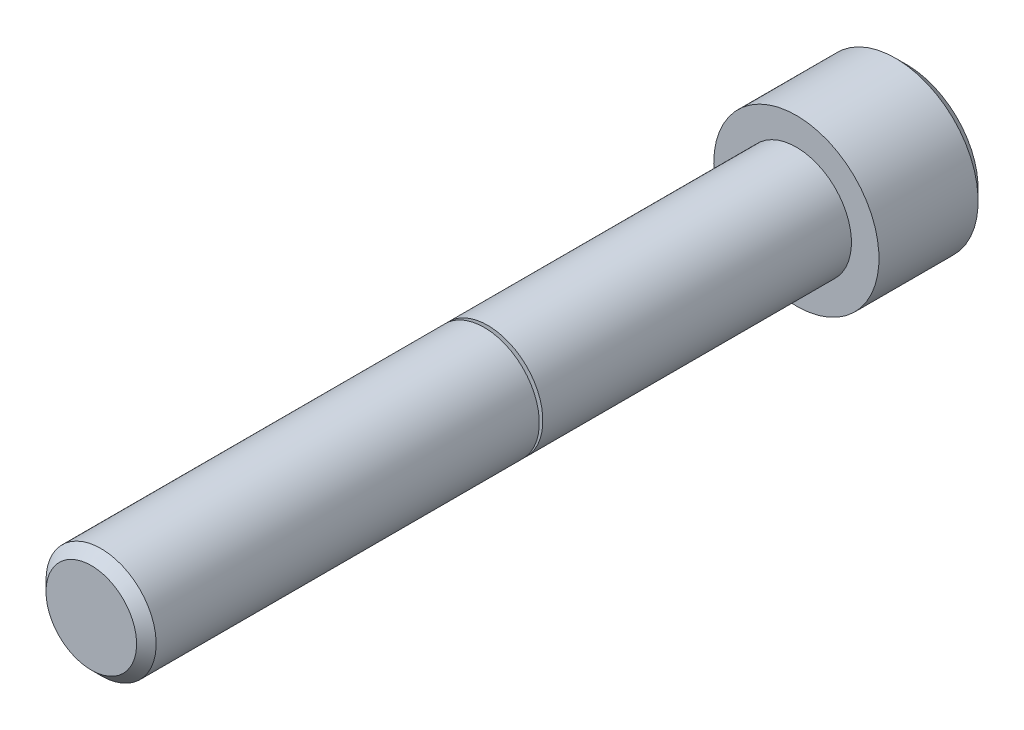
SolidWorks part; units mm, degrees
ref_plane "Front" through (0, 0, 0) normal (0, 0, 1) x (1, 0, 0)
ref_plane "Top" through (0, 0, 0) normal (0, 1, 0) x (1, 0, 0)
ref_plane "Right" through (0, 0, 0) normal (1, 0, 0) x (0, 0, -1)
sketch "Logo3_Revol_Axis" plane through (0, 0, 0) normal (0, 1, 0) x (1, 0, 0)
  line L0 (0, -43.5172) -> (0, 43.5172) construction
sketch "Logo3_bib1" plane through (0, 0, 0) normal (0, -1, 0) x (-1, 0, 0)
  line L0 (0, -50.8) -> (0, 7.9375)
  line L1 (0, 7.9375) -> (5.1594, 7.9375)
  line L2 (5.9531, 7.1437) -> (5.9531, 0)
  line L3 (5.9531, 0) -> (3.9688, 0)
  line L4 (3.9688, 0) -> (3.9688, -22.235)
  line L5 (3.9688, -50.0951) -> (3.2639, -50.8)
  line L6 (3.2639, -50.8) -> (0, -50.8)
  line L7 (3.9688, -22.235) -> (3.3773, -22.235)
  line L8 (3.3705, -22.2738) -> (3.9688, -22.4915)
  line L9 (3.9688, -22.4915) -> (3.9688, -50.0951)
  line L10 (0, 10.5852) -> (0, -63.2873) construction
  line L11 (5.1594, 7.9375) -> (5.9531, 7.1437)
  arc A1 (3.3773, -22.235) -> (3.3705, -22.2738) centre (3.3773, -22.255) ccw
  point P17 (3.2639, -22.235)
  point P19 (5.9531, 7.9375)
revolve "Revolve1" add sketch "Logo3_bib1" angle 360 about L10
sketch "Logo3_bib2" plane through (0, 0, -7.9375) normal (0, 0, -1) x (1, 0, 0)
  line L1 (3.6662, 0) -> (1.8331, 3.175)
  line L2 (1.8331, 3.175) -> (-1.8331, 3.175)
  line L3 (-1.8331, 3.175) -> (-3.6662, 0)
  line L4 (-3.6662, 0) -> (-1.8331, -3.175)
  line L5 (-1.8331, -3.175) -> (1.8331, -3.175)
  line L6 (1.8331, -3.175) -> (3.6662, 0)
  circle A0 centre (0, 0) radius 3.175 construction
  dimension "Logo3_c1" = 6.35
extrude "Cut-Extrude1" cut sketch "Logo3_bib2" against normal blind 3.9688
equation "\"DIA2@Logo3_bib1\" = \"Logo3_d1-pas@Logo3_bib1\""
equation "\"LGT1@Logo3_bib1\" = \"Logo3_d1@Logo3_bib1\""
equation "\"D1@Cut-Extrude1\" = \"Logo3_d1@Logo3_bib1\"/2."
equation "\"D2@Cosmetic Thread1\" = \"Logo3_d1-pas@Logo3_bib1\""
equation "\"D5@Logo3_bib1\"=\"Logo3_d1@Logo3_bib1\"*.1"
